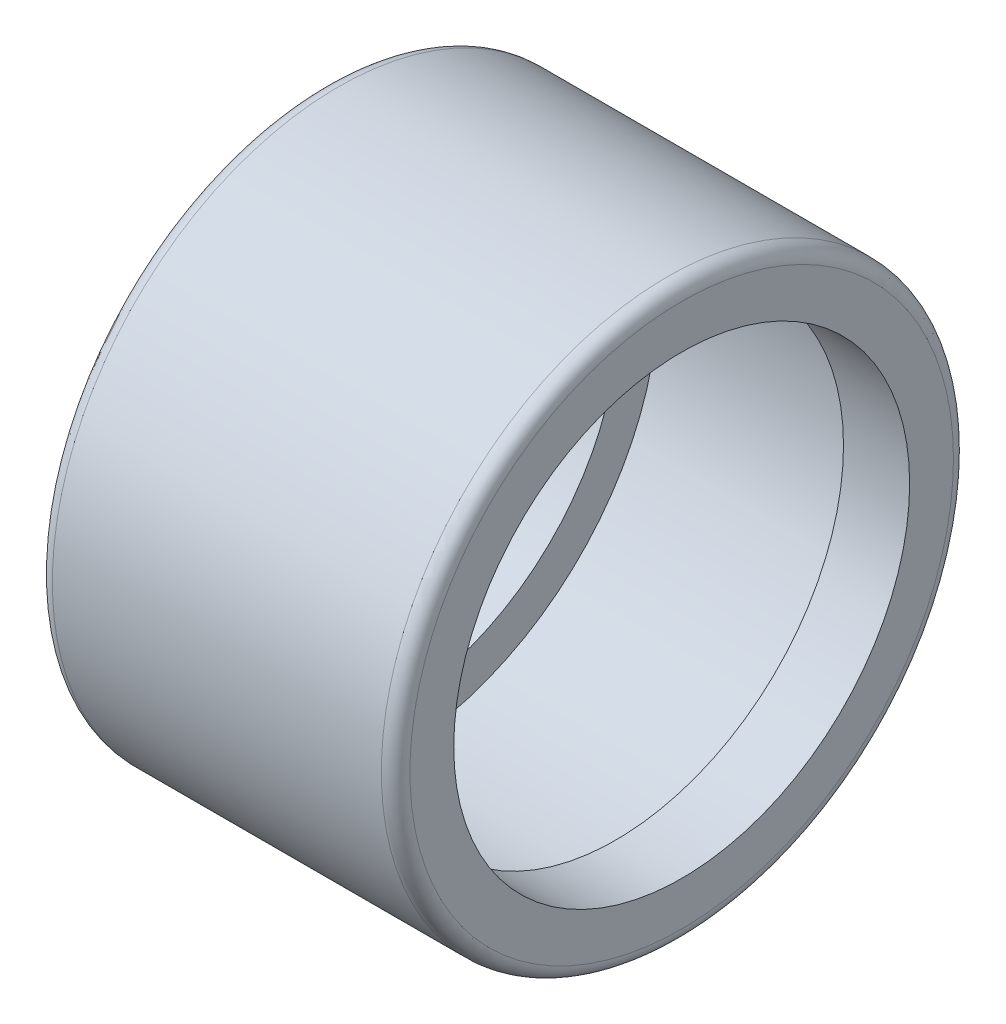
SolidWorks part; units mm, degrees
ref_plane "Front Plane" through (0, 0, 0) normal (0, 0, 1) x (1, 0, 0)
ref_plane "Top Plane" through (0, 0, 0) normal (0, 1, 0) x (1, 0, 0)
ref_plane "Right Plane" through (0, 0, 0) normal (1, 0, 0) x (0, 0, -1)
sketch "Esquisse1" plane through (0, 0, 0) normal (0, 0, 1) x (1, 0, 0)
  line L0 (9.6, 8) -> (0.4, 8)
  line L1 (0, 7.6) -> (0, 6.375)
  line L2 (0, 6.375) -> (1.85, 6.375)
  line L3 (1.85, 6.375) -> (1.85, 7.5)
  line L4 (1.85, 7.5) -> (8.15, 7.5)
  line L5 (8.15, 7.5) -> (8.15, 6.375)
  line L6 (8.15, 6.375) -> (10, 6.375)
  line L7 (10, 6.375) -> (10, 7.6)
  line L8 (-0.0014, 0) -> (10.0014, 0) construction
  arc A0 (0.4, 8) -> (0, 7.6) centre (0.4, 7.6) ccw
  arc A1 (10, 7.6) -> (9.6, 8) centre (9.6, 7.6) ccw
revolve "Révolution1" add sketch "Esquisse1" angle 360 about L8
